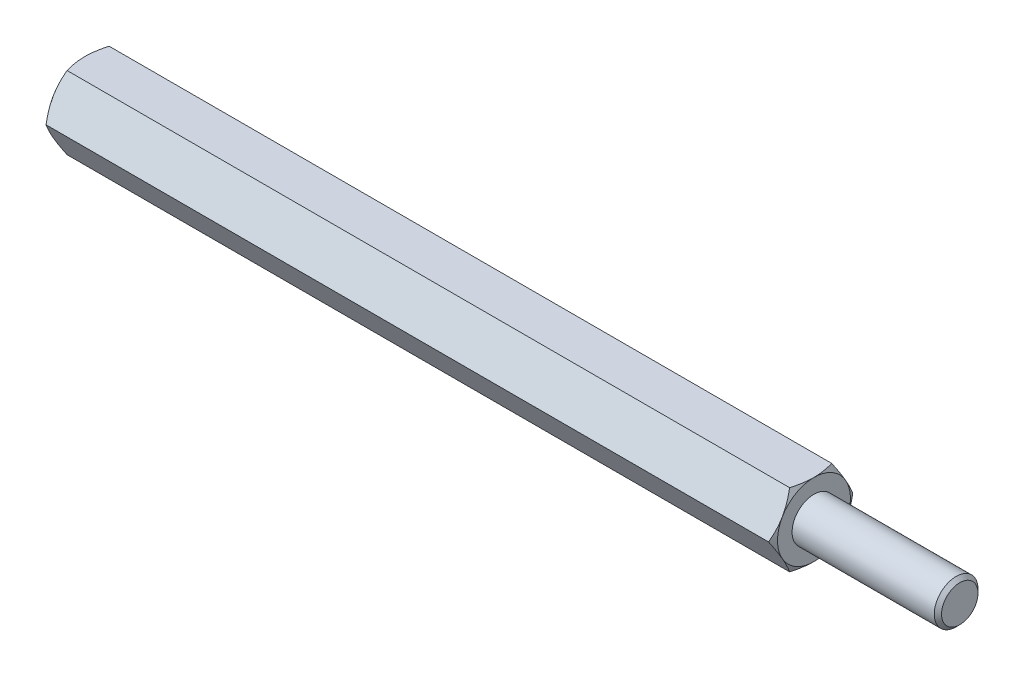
SolidWorks part; units mm, degrees
ref_plane "Front Plane" through (0, 0, 0) normal (0, 0, 1) x (1, 0, 0)
ref_plane "Top Plane" through (0, 0, 0) normal (0, 1, 0) x (1, 0, 0)
ref_plane "Right Plane" through (0, 0, 0) normal (1, 0, 0) x (0, 0, -1)
sketch "Sketch1" plane through (0, 0, 0) normal (1, 0, 0) x (0, 0, -1)
  line L1 (1.4434, 2.5) -> (-1.4434, 2.5)
  line L2 (-1.4434, 2.5) -> (-2.8868, 0)
  line L3 (-2.8868, 0) -> (-1.4434, -2.5)
  line L4 (-1.4434, -2.5) -> (1.4434, -2.5)
  line L5 (1.4434, -2.5) -> (2.8868, 0)
  line L6 (2.8868, 0) -> (1.4434, 2.5)
  circle A0 centre (0, 0) radius 2.5 construction
  dimension "D1" = 5
extrude "Extrude2" add sketch "Sketch1" along normal mid plane 50
sketch "Sketch2" plane through (0, 0, 0) normal (0, 0, 1) x (1, 0, 0)
  line L0 (-25, 2.5) -> (-23.5, 5.0981)
  line L1 (-25, 5.5) -> (-25, 2.5)
  line L3 (0, 0) -> (50000, 0) construction
  arc A0 (-23.5, 5.0981) -> (-25, 5.5) centre (-24.1962, 5.5) ccw
  dimension "D1" = 30
  dimension "D2" = 3
revolve "Cut-Revolve1" cut sketch "Sketch2" angle 360 about L3
mirror "Mirror1" about plane through (0, 0, 0) normal (1, 0, 0) of "Cut-Revolve1"
sketch "Sketch3" plane through (-25, 0, 0) normal (-1, 0, 0) x (0, 0, 1)
  circle A0 centre (0, 0) radius 1.25
  dimension "D1" = 2.5
extrude "Extrude3" cut sketch "Sketch3" against normal blind 10
sketch "Sketch4" plane through (0, 0, 0) normal (0, 0, 1) x (1, 0, 0)
  line L0 (-15, 0) -> (-15, 1.25)
  line L1 (24.7767, 0) -> (-24.7767, 0) construction
  line L2 (-15, 1.25) -> (-14.2783, 0)
  line L3 (-14.2783, 0) -> (-15, 0)
  line L4 (-25, 1.25) -> (-25, -1.25) construction
  point P4 (-25, 0)
  dimension "D1" = 30
  dimension "D2" = 1.25
  dimension "D3" = 10
revolve "Cut-Revolve2" cut sketch "Sketch4" angle 360 about L3
sketch "Sketch5" plane through (25, 0, 0) normal (1, 0, 0) x (0, 0, -1)
  circle A0 centre (0, 0) radius 1.5
  dimension "D1" = 3
extrude "Extrude4" add sketch "Sketch5" along normal blind 10
chamfer "Chamfer1" distance 0.25 angle 45 1 edges at (35, 0, -1.5)
equation "\"D2@Sketch4\" = \"D1@Sketch3\"/2"
